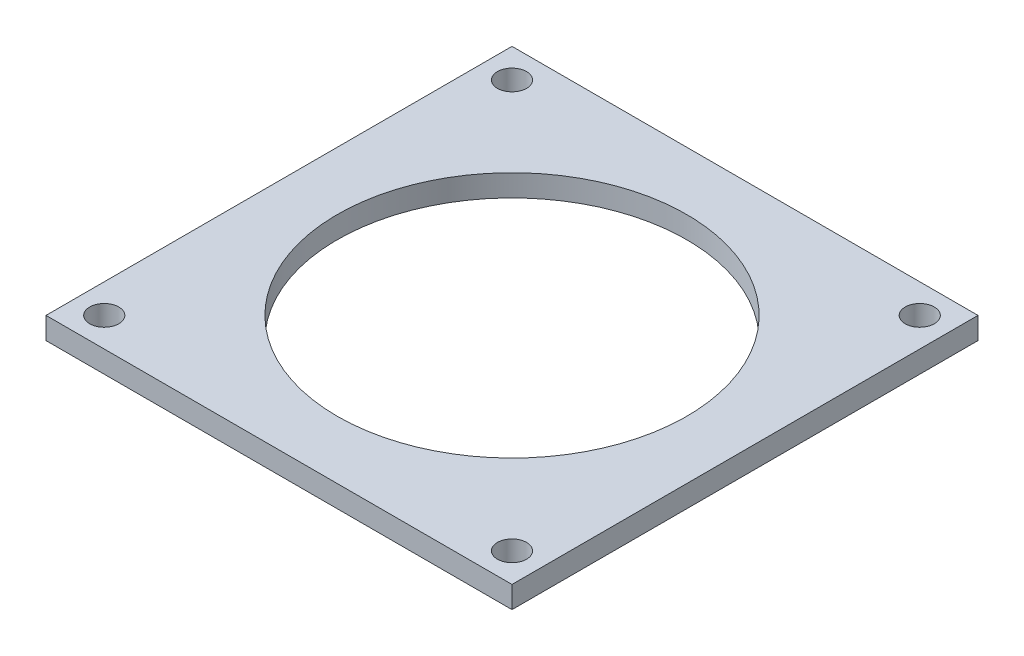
SolidWorks part; units mm, degrees
ref_plane "Front Plane" through (0, 0, 0) normal (0, 0, 1) x (1, 0, 0)
ref_plane "Top Plane" through (0, 0, 0) normal (0, 1, 0) x (1, 0, 0)
ref_plane "Right Plane" through (0, 0, 0) normal (1, 0, 0) x (0, 0, -1)
sketch "Sketch1" plane through (0, 0, 0) normal (0, 1, 0) x (1, 0, 0)
  line L1 (50.8, 50.8) -> (-50.8, 50.8)
  line L2 (50.8, 50.8) -> (50.8, -50.8)
  line L3 (50.8, -50.8) -> (-50.8, -50.8)
  line L4 (-50.8, 50.8) -> (-50.8, -50.8)
  line L5 (50.8, 50.8) -> (-50.8, -50.8) construction
  line L6 (50.8, -50.8) -> (-50.8, 50.8) construction
  point P0 (0, 0)
  dimension "D1" = 101.6
  dimension "D2" = 101.6
extrude "Boss-Extrude1" add sketch "Sketch1" along normal blind 4.7625
sketch "Sketch2" plane through (0, 4.7625, 0) normal (0, 1, 0) x (1, 0, 0)
  line L0 (50.8, 50.8) -> (-50.8, 50.8) construction
  line L2 (-50.8, 50.8) -> (-50.8, -50.8) construction
  circle A0 centre (-44.45, 44.45) radius 3.175
  circle A1 centre (44.45, 44.45) radius 3.175
  circle A2 centre (44.45, -44.45) radius 3.175
  circle A3 centre (-44.45, -44.45) radius 3.175
  circle A4 centre (0, 0) radius 38.1
  dimension "D1" = 6.35
  dimension "D6" = 76.2
  dimension "D2" = 6.35
  dimension "D3" = 6.35
  dimension "D4" = 2
  dimension "D5" = 2
extrude "Cut-Extrude1" cut sketch "Sketch2" against normal through all
